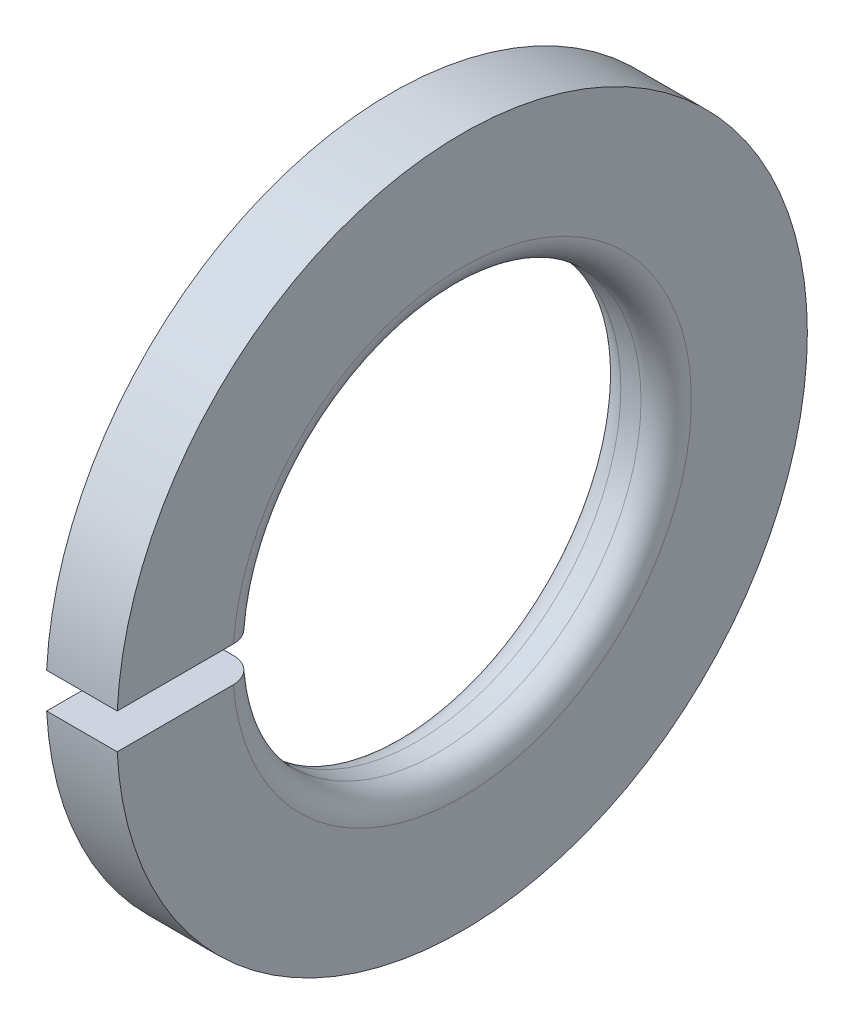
SolidWorks part; units mm, degrees
ref_plane "Plane1" through (0, 0, 0) normal (0, 0, 1) x (1, 0, 0)
ref_plane "Plane2" through (0, 0, 0) normal (0, 1, 0) x (1, 0, 0)
ref_plane "Plane3" through (0, 0, 0) normal (1, 0, 0) x (0, 0, -1)
sketch "Sketch1" plane through (0, 0, 0) normal (0, 0, 1) x (1, 0, 0)
  line L0 (-34.925, 0) -> (9.525, 0) construction
  line L1 (0, 9.1) -> (0, 13.7)
  line L2 (0, 13.7) -> (-2.8, 13.7)
  line L3 (-2.8, 13.7) -> (-2.8, 9.1)
  line L4 (-1.8, 8.1) -> (-1, 8.1)
  arc A0 (-1.8, 8.1) -> (-2.8, 9.1) centre (-1.8, 9.1) cw
  arc A1 (0, 9.1) -> (-1, 8.1) centre (-1, 9.1) cw
  point P8 (-2.8, 8.1)
  dimension "Fillet_rad" = 1
  dimension "D1" = 1
  dimension "Thickness" = 2.8
  dimension "Inside_dia" = 16.2
  dimension "Outside_dia" = 27.4
revolve "Base-Revolve" add sketch "Sketch1" angle 360 about L0
sketch "Sketch2" plane through (0, 0, 0) normal (-1, 0, 0) x (0, -1, 0)
  line L0 (-0.7, 0) -> (0.7, 0)
  line L1 (0, 0) -> (0, 12.7) construction
  line L2 (0.7, 0) -> (0.7, 13.974)
  line L3 (0.7, 13.974) -> (-0.7, 13.974)
  line L4 (-0.7, 13.974) -> (-0.7, 0)
  dimension "D1" = 1.4
  dimension "D2" = 13.974
extrude "Gap" cut sketch "Sketch2" along normal through all
equation "\"D1@Sketch1\" = \"Fillet_rad@Sketch1\""
equation "\"D1@Sketch2\" = \"Thickness@Sketch1\" * 0.5"
equation "\"D2@Sketch2\" = \"Outside_dia@Sketch1\" * 0.51"
